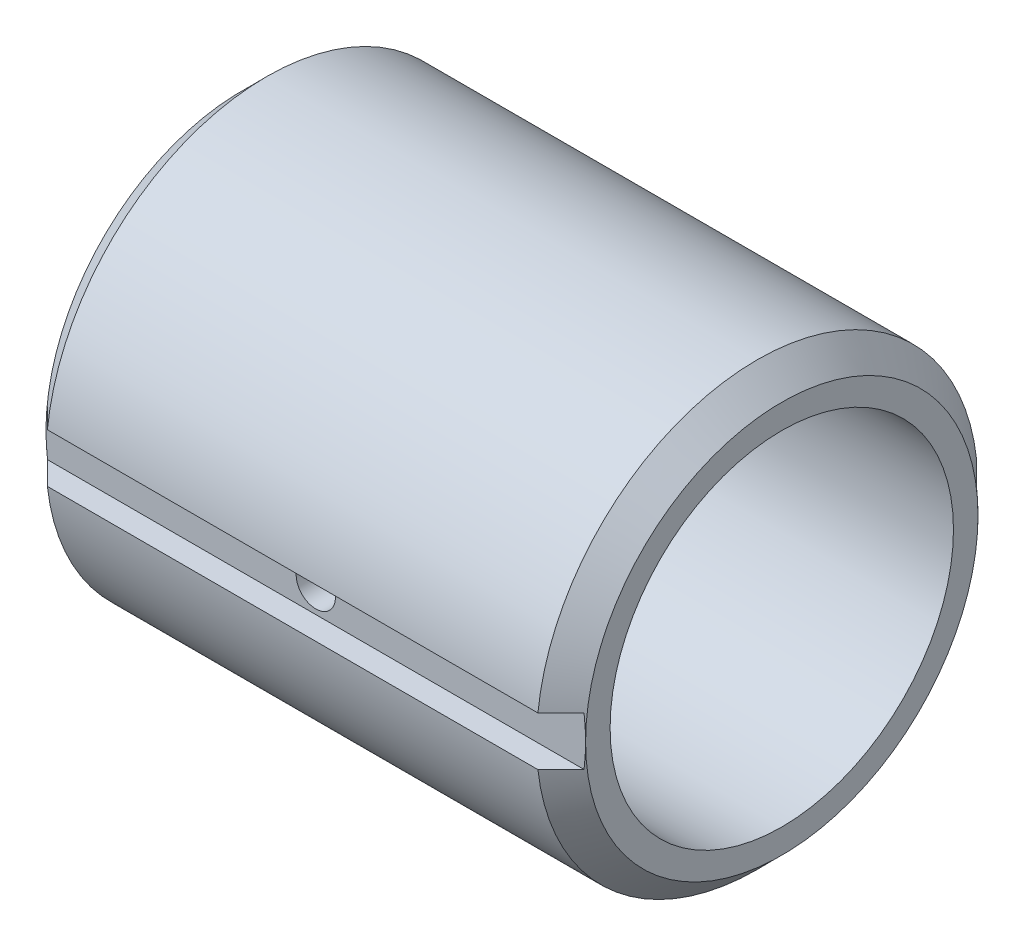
SolidWorks part; units mm, degrees
ref_plane "Front Plane" through (0, 0, 0) normal (0, 0, 1) x (1, 0, 0)
ref_plane "Top Plane" through (0, 0, 0) normal (0, 1, 0) x (1, 0, 0)
ref_plane "Right Plane" through (0, 0, 0) normal (1, 0, 0) x (0, 0, -1)
sketch "Sketch1" plane through (0, 0, 0) normal (0, 0, 1) x (1, 0, 0)
  line L0 (-63.0595, -29.0187) -> (-63.0595, 21.7813)
  line L1 (-63.0595, 21.7813) -> (-56.7095, 28.1313)
  line L2 (-56.7095, 28.1313) -> (70.2905, 28.1313)
  line L3 (70.2905, 28.1313) -> (76.6405, 21.7813)
  line L4 (76.6405, 21.7813) -> (76.6405, -29.0187)
  line L5 (76.6405, -29.0187) -> (-63.0595, -29.0187)
  dimension "D1" = 127
  dimension "D2" = 50.8
  dimension "D3" = 6.35
  dimension "D4" = 6.35
  dimension "D5" = 6.35
  dimension "D6" = 6.35
revolve "Revolve1" add sketch "Sketch1" angle 360 about L5
sketch "Sketch2" plane through (76.6405, 0, 0) normal (1, 0, 0) x (0, 0, -1)
  line L0 (-50.8, -22.6687) -> (-50.8, -35.3687)
  line L1 (-50.8, -22.6687) -> (-63.5, -22.6687)
  line L2 (-50.8, -35.3687) -> (-63.5, -35.3687)
  line L3 (-63.5, -22.6687) -> (-63.5, -35.3687)
  line L8 (50.8, -22.6687) -> (50.8, -35.3687)
  line L9 (50.8, -22.6687) -> (63.5, -22.6687)
  line L10 (50.8, -35.3687) -> (63.5, -35.3687)
  line L11 (63.5, -22.6687) -> (63.5, -35.3687)
  circle A1 centre (0, -29.0187) radius 50.8 construction
  point P13 (0, 0)
  dimension "D2" = 6.35
  dimension "D1" = 12.7
  dimension "D3" = 12.7
  dimension "D4" = 12.7
  dimension "D5" = 12.7
  dimension "D6" = 50.8
  dimension "D7" = 50.8
  dimension "D8" = 12.7
  dimension "D9" = 0
extrude "Cut-Extrude1" cut sketch "Sketch2" against normal blind 152.4
sketch "Sketch4" plane through (76.6405, 0, 0) normal (1, 0, 0) x (0, 0, -1)
  circle A0 centre (0, -29.0187) radius 44.45
  arc A1 (50.8, -29.0187) -> (-50.8, -29.0187) centre (0, -29.0187) ccw construction
  dimension "D1" = 88.9
  dimension "D2" = 0
extrude "Cut-Extrude2" cut sketch "Sketch4" against normal blind 152.4
sketch "Sketch5" plane through (0, 0, -50.8) normal (0, 0, -1) x (-1, 0, 0)
  line L0 (-70.2905, 28.1313) -> (-70.2905, -22.6687) construction
  line L1 (62.6641, -22.6687) -> (-76.2452, -22.6687) construction
  circle A0 centre (-6.7905, -29.0187) radius 5.08
  dimension "D2" = 10.16
  dimension "D3" = 10.16
  dimension "D4" = 6.35
  dimension "D1" = 63.5
extrude "Cut-Extrude3" cut sketch "Sketch5" against normal blind 152.4
